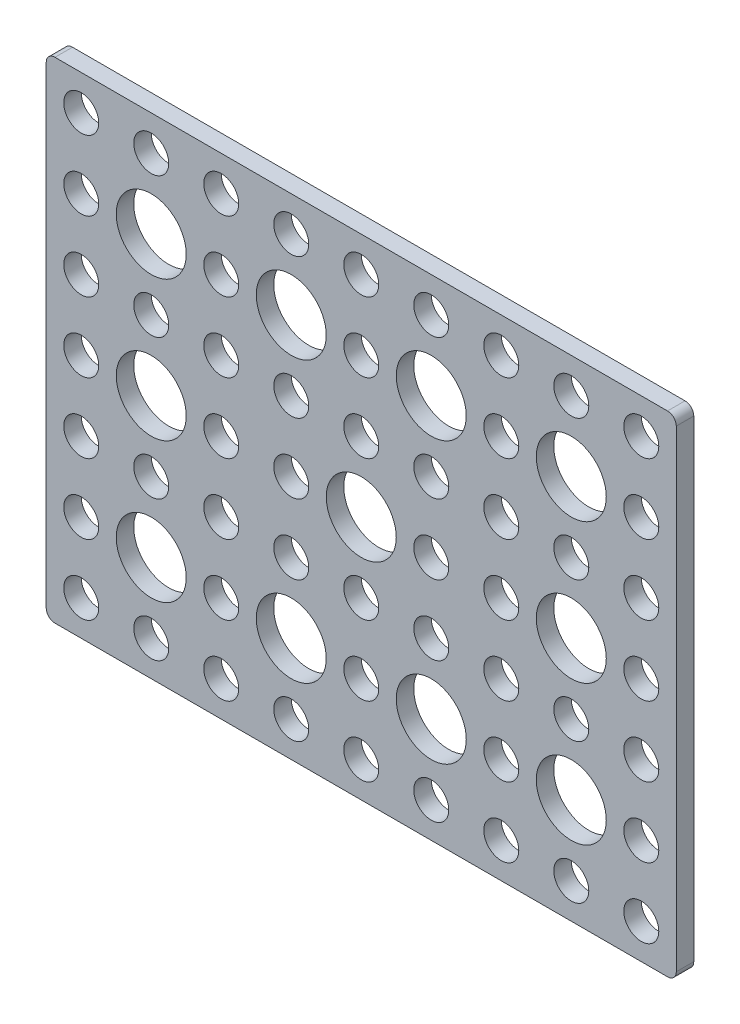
SolidWorks part; units mm, degrees
ref_plane "前视基准面" through (0, 0, 0) normal (0, 0, 1) x (1, 0, 0)
ref_plane "上视基准面" through (0, 0, 0) normal (0, 1, 0) x (1, 0, 0)
ref_plane "右视基准面" through (0, 0, 0) normal (1, 0, 0) x (0, 0, -1)
sketch "草图1" plane through (0, 0, 0) normal (0, 0, 1) x (1, 0, 0)
  line L0 (0, 56) -> (0, 0)
  line L3 (0, 56) -> (-72, 56)
  line L4 (-72, 0) -> (-72, 56)
  line L9 (0, 0) -> (-72, 0)
  circle A0 centre (-4, 4) radius 2
  circle A1 centre (-4, 12) radius 2
  circle A2 centre (-4, 20) radius 2
  circle A3 centre (-4, 28) radius 2
  circle A4 centre (-4, 36) radius 2
  circle A5 centre (-4, 44) radius 2
  circle A6 centre (-4, 52) radius 2
  circle A7 centre (-12, 4) radius 2
  circle A9 centre (-12, 20) radius 2
  circle A11 centre (-12, 36) radius 2
  circle A13 centre (-12, 52) radius 2
  circle A14 centre (-20, 4) radius 2
  circle A15 centre (-20, 12) radius 2
  circle A16 centre (-20, 20) radius 2
  circle A17 centre (-20, 28) radius 2
  circle A18 centre (-20, 36) radius 2
  circle A19 centre (-20, 44) radius 2
  circle A20 centre (-20, 52) radius 2
  circle A21 centre (-28, 4) radius 2
  circle A23 centre (-28, 20) radius 2
  circle A24 centre (-28, 28) radius 2
  circle A25 centre (-28, 36) radius 2
  circle A27 centre (-28, 52) radius 2
  circle A28 centre (-36, 4) radius 2
  circle A29 centre (-36, 12) radius 2
  circle A30 centre (-36, 20) radius 2
  circle A32 centre (-36, 36) radius 2
  circle A33 centre (-36, 44) radius 2
  circle A34 centre (-36, 52) radius 2
  circle A35 centre (-44, 4) radius 2
  circle A37 centre (-44, 20) radius 2
  circle A38 centre (-44, 28) radius 2
  circle A39 centre (-44, 36) radius 2
  circle A41 centre (-44, 52) radius 2
  circle A42 centre (-52, 4) radius 2
  circle A43 centre (-52, 12) radius 2
  circle A44 centre (-52, 20) radius 2
  circle A45 centre (-52, 28) radius 2
  circle A46 centre (-52, 36) radius 2
  circle A47 centre (-52, 44) radius 2
  circle A48 centre (-52, 52) radius 2
  circle A49 centre (-60, 4) radius 2
  circle A51 centre (-60, 20) radius 2
  circle A53 centre (-60, 36) radius 2
  circle A55 centre (-60, 52) radius 2
  circle A56 centre (-68, 4) radius 2
  circle A57 centre (-68, 12) radius 2
  circle A58 centre (-68, 20) radius 2
  circle A59 centre (-68, 28) radius 2
  circle A60 centre (-68, 36) radius 2
  circle A61 centre (-68, 44) radius 2
  circle A62 centre (-68, 52) radius 2
  circle A63 centre (-60, 44) radius 2
  circle A64 centre (-44, 44) radius 2
  circle A65 centre (-28, 44) radius 2
  circle A66 centre (-12, 44) radius 2
  circle A67 centre (-60, 28) radius 2
  circle A68 centre (-36, 28) radius 2
  circle A69 centre (-60, 12) radius 2
  circle A70 centre (-44, 12) radius 2
  circle A71 centre (-28, 12) radius 2
  circle A72 centre (-12, 12) radius 2
  circle A73 centre (-12, 28) radius 2
  circle A74 centre (-60, 44) radius 4
  circle A75 centre (-44, 44) radius 4
  circle A76 centre (-28, 44) radius 4
  circle A77 centre (-12, 44) radius 4
  circle A78 centre (-60, 12) radius 4
  circle A79 centre (-44, 12) radius 4
  circle A80 centre (-28, 12) radius 4
  circle A81 centre (-12, 12) radius 4
  circle A82 centre (-60, 28) radius 4
  circle A83 centre (-36, 28) radius 4
  circle A84 centre (-12, 28) radius 4
  dimension "D1" = 7
  dimension "D3" = 2
  dimension "D2" = 9
  dimension "D4" = 3
  dimension "D5" = 2
  dimension "D6" = 2
  dimension "D7" = 3
extrude "凸台-拉伸1" add sketch "草图1" along normal blind 2
fillet "圆角1" radius 1 1 edges at (0, 0, 1)
fillet "圆角2" radius 1 1 edges at (0, 56, 1)
fillet "圆角3" radius 1 1 edges at (-72, 56, 1)
fillet "圆角4" radius 1 1 edges at (-72, 0, 1)
